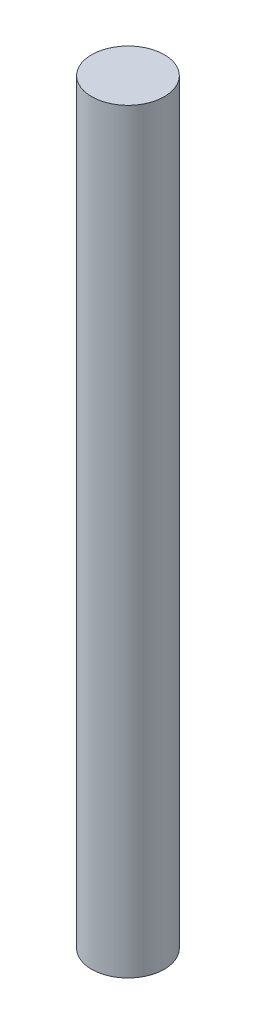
SolidWorks part; units mm, degrees
ref_plane "Front Plane" through (0, 0, 0) normal (0, 0, 1) x (1, 0, 0)
ref_plane "Top Plane" through (0, 0, 0) normal (0, 1, 0) x (1, 0, 0)
ref_plane "Right Plane" through (0, 0, 0) normal (1, 0, 0) x (0, 0, -1)
sketch "Sketch1" plane through (0, 0, 0) normal (0, 1, 0) x (1, 0, 0)
  circle A0 centre (0, 0) radius 0.7937
  dimension "D1" = 1.5875
extrude "Boss-Extrude1" add sketch "Sketch1" along normal blind 16.51
